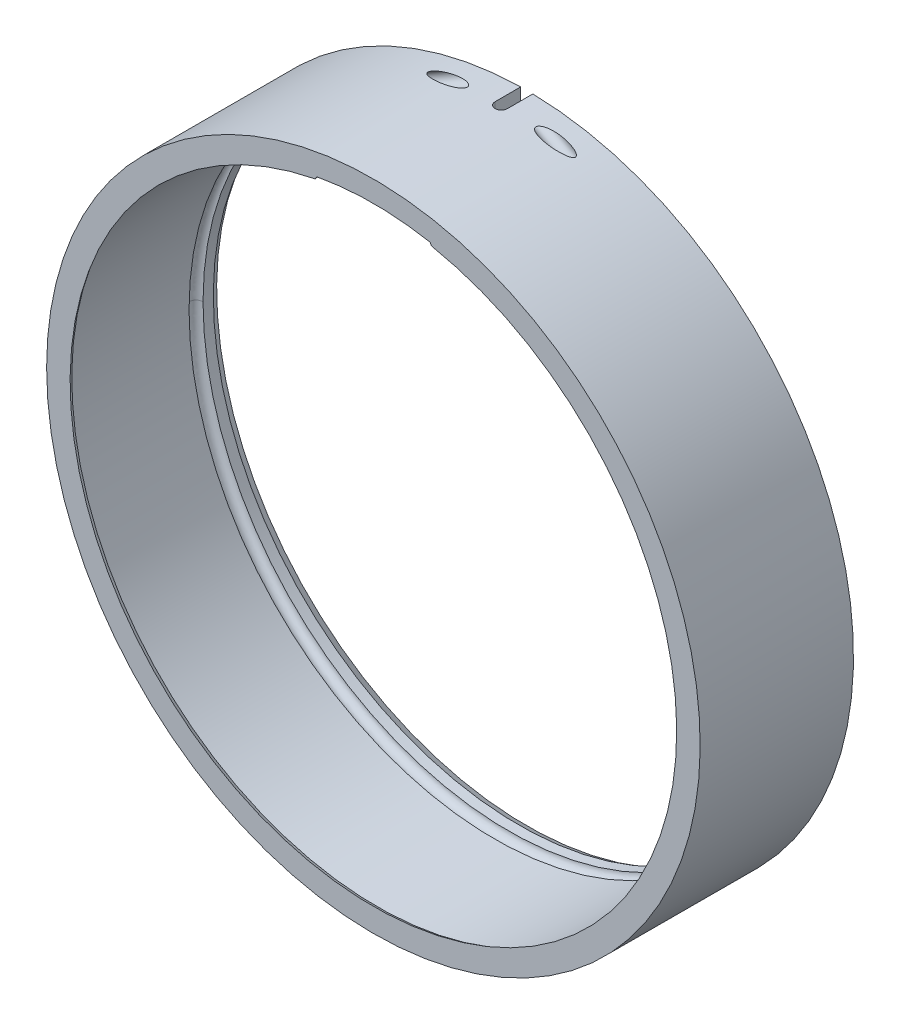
SolidWorks part; units mm, degrees
ref_plane "Front Plane" through (0, 0, 0) normal (0, 0, 1) x (1, 0, 0)
ref_plane "Top Plane" through (0, 0, 0) normal (0, 1, 0) x (1, 0, 0)
ref_plane "Right Plane" through (0, 0, 0) normal (1, 0, 0) x (0, 0, -1)
imported_body "Imported1"
sketch "Sketch1" plane through (0, 0, 0) normal (1, 0, 0) x (0, 0, -1)
  line L1 (373.6665, 96.8304) -> (25, 96.8304)
  line L2 (373.6665, -0.7136) -> (373.6665, 96.8304)
  line L3 (373.6665, -92.6403) -> (25, -92.6403)
  line L4 (25, 96.8304) -> (25, -92.6403)
  line L5 (373.6665, -77.2101) -> (373.6665, 75.783) construction
  line L7 (373.6665, -0.7136) -> (373.6665, -92.6403)
extrude "Cut-Extrude1" cut sketch "Sketch1" against normal through all both and the other way through all
sketch "Sketch2" plane through (0, 0, -373.6665) normal (0, 0, 1) x (1, 0, 0)
  circle A0 centre (0, 0) radius 77.2101
  circle A1 centre (0, 0) radius 83.185
extrude "Boss-Extrude1" add sketch "Sketch2" along normal blind 348.6658
sketch "Sketch5" plane through (0, 0, 0) normal (1, 0, 0) x (0, 0, -1)
  line L1 (373.6665, -104.6085) -> (-23.0643, -104.6085)
  line L2 (373.6665, -104.6085) -> (373.6665, 112.4834)
  line L3 (373.6665, 112.4834) -> (-23.0643, 112.4834)
  line L4 (-23.0643, -104.6085) -> (-23.0643, 112.4834)
extrude "Cut-Extrude2" cut sketch "Sketch5" against normal through all both and the other way through all
